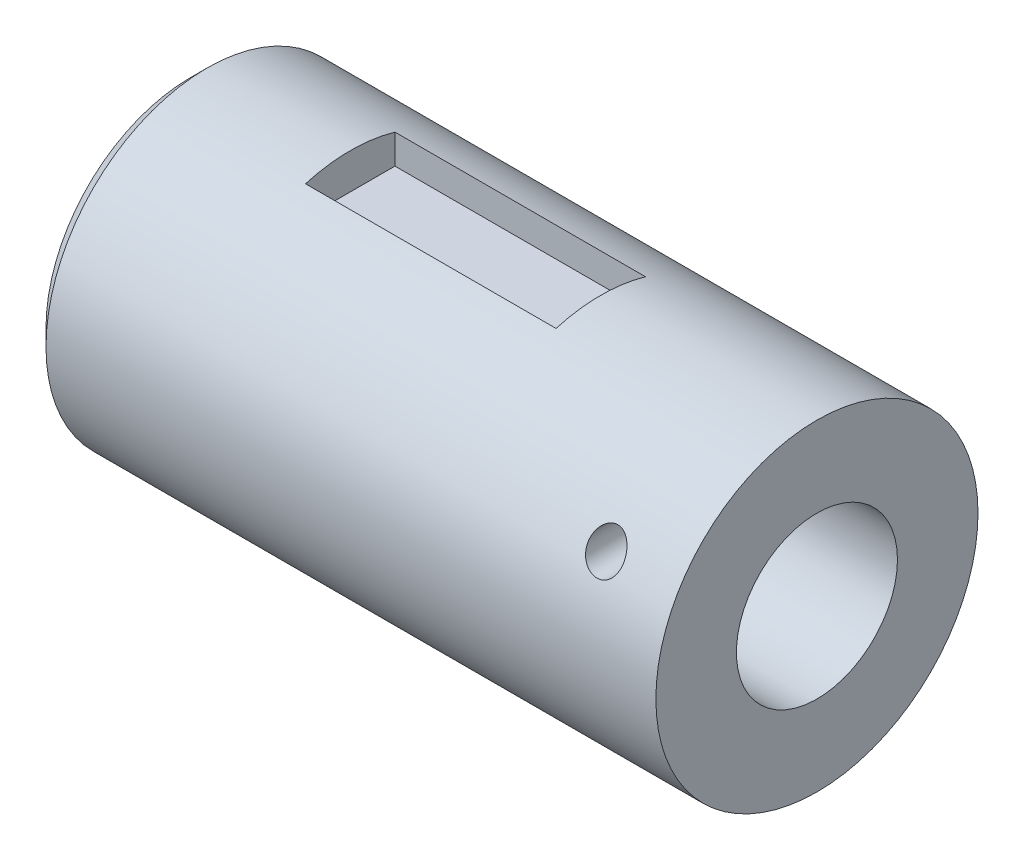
SolidWorks part; units mm, degrees
ref_plane "Front Plane" through (0, 0, 0) normal (0, 0, 1) x (1, 0, 0)
ref_plane "Top Plane" through (0, 0, 0) normal (0, 1, 0) x (1, 0, 0)
ref_plane "Right Plane" through (0, 0, 0) normal (1, 0, 0) x (0, 0, -1)
sketch "Sketch1" plane through (0, 0, 0) normal (0, 0, 1) x (1, 0, 0)
  line L0 (38.6819, 0) -> (-59.4021, 0) construction
  line L1 (-59.4021, 14) -> (-59.4021, 16.1599)
  line L2 (-59.4021, 16.1599) -> (-57.5619, 18)
  line L7 (-57.5619, 18) -> (10.5979, 18)
  line L8 (10.5979, 18) -> (10.5979, 9)
  line L9 (10.5979, 9) -> (-3.4021, 9)
  line L10 (-3.4021, 9) -> (-3.4021, 12)
  line L11 (-3.4021, 12) -> (-13.4021, 12)
  line L12 (-13.4021, 12) -> (-13.4021, 9)
  line L13 (-13.4021, 9) -> (-49.4021, 9)
  line L15 (-49.4021, 9) -> (-49.4021, 14)
  line L16 (-49.4021, 14) -> (-59.4021, 14)
  point P16 (3.5979, 9)
  dimension "D1" = 12
  dimension "D2" = 9
  dimension "D3" = 9
  dimension "D4" = 14
  dimension "D5" = 10
  dimension "D8" = 70
  dimension "D9" = 56
  dimension "D10" = 10
  dimension "D11" = 225
  dimension "D12" = 18
revolve "Revolve1" add sketch "Sketch1" angle 360 about L0
sketch "Sketch2" plane through (0, 0, 0) normal (0, 0, 1) x (1, 0, 0)
  line L1 (7.7907, 9) -> (-5.4207, 9) construction
  line L2 (10.5979, -18) -> (10.5979, 18) construction
  circle A1 centre (2.5979, 9) radius 2
  dimension "D1" = 4
  dimension "D2" = 8
extrude "Cut-Extrude1" cut sketch "Sketch2" against normal blind 41 and the other way blind 30
ref_plane "Plane1" through (0, 18, 0) normal (0, 1, 0) x (1, 0, 0)
sketch "Sketch3" plane through (0, 18, 0) normal (0, 1, 0) x (1, 0, 0)
  line L0 (-27.5619, 0) -> (-57.5619, 0) construction
  line L1 (-41.5619, 5) -> (-13.5619, 5)
  line L2 (-41.5619, 5) -> (-41.5619, -5)
  line L3 (-41.5619, -5) -> (-13.5619, -5)
  line L4 (-13.5619, 5) -> (-13.5619, -5)
  line L5 (-41.5619, 5) -> (-13.5619, -5) construction
  line L6 (-41.5619, -5) -> (-13.5619, 5) construction
  line L7 (-57.5619, 18) -> (-57.5619, -18) construction
  point P0 (-27.5619, 0)
  dimension "D1" = 10
  dimension "D2" = 16
  dimension "D3" = 28
extrude "Cut-Extrude2" cut sketch "Sketch3" against normal blind 4
